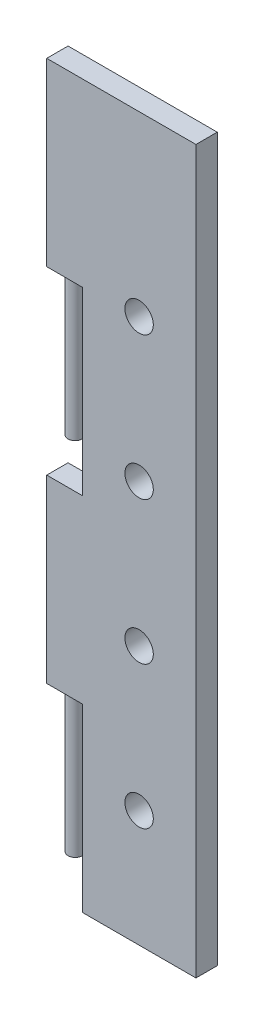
SolidWorks part; units mm, degrees
ref_plane "Front Plane" through (0, 0, 0) normal (0, 0, 1) x (1, 0, 0)
ref_plane "Top Plane" through (0, 0, 0) normal (0, 1, 0) x (1, 0, 0)
ref_plane "Right Plane" through (0, 0, 0) normal (1, 0, 0) x (0, 0, -1)
sketch "Sketch1" plane through (0, 0, 0) normal (0, 0, 1) x (1, 0, 0)
  line L0 (0, 50.8) -> (0, 25.8) construction
  line L1 (-8, 50.8) -> (8, 50.8)
  line L2 (-8, 50.8) -> (-8, -50.8)
  line L3 (-8, -50.8) -> (8, -50.8)
  line L4 (8, 50.8) -> (8, -50.8)
  line L5 (-8, 50.8) -> (8, -50.8) construction
  line L6 (-8, -50.8) -> (8, 50.8) construction
  circle A0 centre (0, 25.8) radius 2
  circle A1 centre (0, 5.734) radius 2
  circle A2 centre (0, -14.332) radius 2
  circle A3 centre (0, -34.398) radius 2
  point P0 (0, 0)
  dimension "D4" = 4
  dimension "D1" = 16
  dimension "D2" = 101.6
  dimension "D3" = 25
  dimension "D5" = 4
extrude "Boss-Extrude1" add sketch "Sketch1" along normal blind 3
sketch "Sketch3" plane through (-8, 0, 0) normal (-1, 0, 0) x (0, 0, 1)
  line L0 (3, 50.8) -> (3, -50.8) construction
  line L1 (0, 50.8) -> (3, 50.8)
  line L2 (0, 50.8) -> (0, 25.4)
  line L3 (0, 25.4) -> (3, 25.4)
  line L4 (3, 50.8) -> (3, 25.4)
  line L5 (3, 25.4) -> (3, 0) construction
  line L6 (0, 50.8) -> (0, -50.8) construction
  line L7 (3, 0) -> (0, 0)
  line L8 (3, 0) -> (3, -25.4)
  line L9 (3, -25.4) -> (0, -25.4)
  line L10 (0, 0) -> (0, -25.4)
  line L11 (3, -50.8) -> (3, -25.4) construction
  dimension "D1" = 25.4
  dimension "D2" = 25.4
  dimension "D3" = 25.4
extrude "Boss-Extrude3" add sketch "Sketch3" along normal blind 5
sketch "Sketch6" plane through (0, 25.4, 0) normal (0, -1, 0) x (1, 0, 0)
  line L0 (-13, 1.5) -> (-8, 1.5) construction
  line L1 (-13, 0) -> (-13, 3) construction
  line L2 (-8, 0) -> (-8, 3) construction
  circle A0 centre (-10.5, 1.5) radius 1
  dimension "D1" = 2
sketch "Sketch7" plane through (0, -25.4, 0) normal (0, -1, 0) x (1, 0, 0)
  line L0 (-13, 1.5) -> (-8, 1.5) construction
  line L1 (-13, 0) -> (-13, 3) construction
  line L2 (-8, 0) -> (-8, 3) construction
  circle A0 centre (-10.5, 1.5) radius 1
  dimension "D1" = 2
extrude "Boss-Extrude4" add sketch "Sketch7" along normal blind 20
extrude "Boss-Extrude5" add sketch "Sketch6" along normal blind 20
